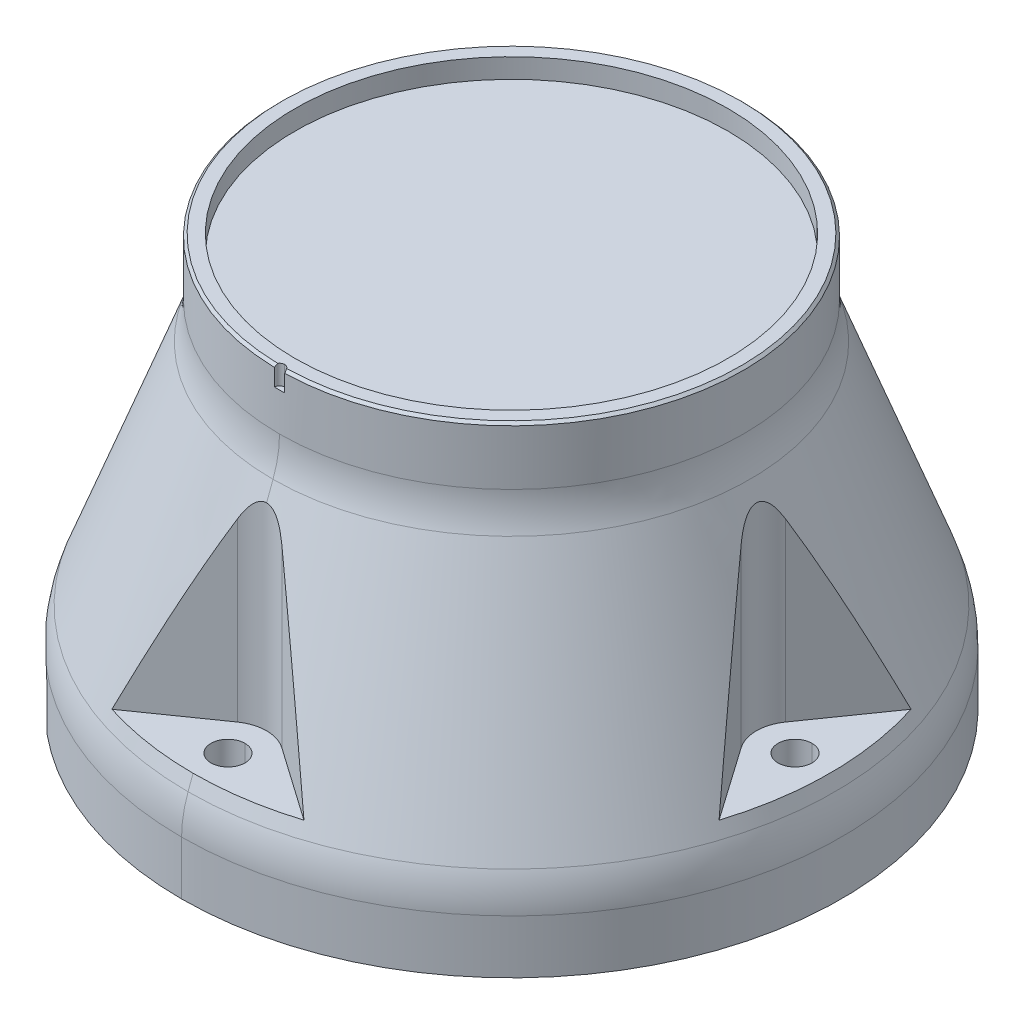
SolidWorks part; units mm, degrees
ref_plane "前视基准面" through (0, 0, 0) normal (0, 0, 1) x (1, 0, 0)
ref_plane "上视基准面" through (0, 0, 0) normal (0, 1, 0) x (1, 0, 0)
ref_plane "右视基准面" through (0, 0, 0) normal (1, 0, 0) x (0, 0, -1)
imported_body "输入1"
other "移动面1" parameters "D1"=0.8
move or copy body "实体-移动/复制1" bodies to move or copy 113 copy no rotation origin (0, 0, 0) rotation axis (0, 1, 0) rotation angle 180
other "删除面1"
other "删除面2"
sketch "草图2" plane through (0, 76, 0) normal (0, 1, 0) x (1, 0, 0)
  circle A0 centre (0, 0) radius 42
extrude "凸台-拉伸3" add sketch "草图2" against normal blind 30
sketch "草图3" plane through (0, 45, 0) normal (0, -1, 0) x (1, 0, 0)
  circle A0 centre (0, 0) radius 46
